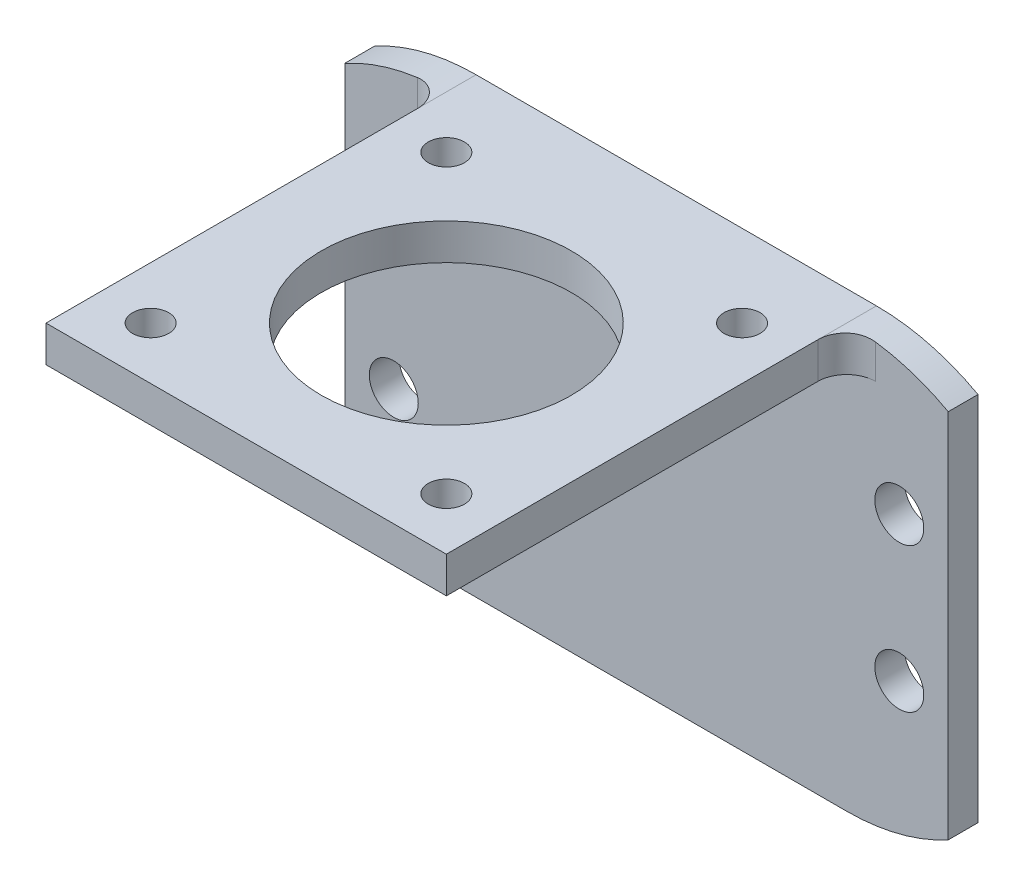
SolidWorks part; units mm, degrees
ref_plane "Front Plane" through (0, 0, 0) normal (0, 0, 1) x (1, 0, 0)
ref_plane "Top Plane" through (0, 0, 0) normal (0, 1, 0) x (1, 0, 0)
ref_plane "Right Plane" through (0, 0, 0) normal (1, 0, 0) x (0, 0, -1)
sketch "Sketch1" plane through (0, 0, 0) normal (0, 1, 0) x (1, 0, 0)
  line L0 (-13, 13) -> (-13, -13) construction
  line L1 (-17.6, -17.6) -> (17.6, -17.6)
  line L2 (-17.6, -17.6) -> (-17.6, 17.6)
  line L3 (-17.6, 17.6) -> (17.6, 17.6)
  line L4 (17.6, -17.6) -> (17.6, 17.6)
  line L5 (-17.6, -17.6) -> (17.6, 17.6) construction
  line L6 (-17.6, 17.6) -> (17.6, -17.6) construction
  line L7 (-13, -13) -> (13, -13) construction
  circle A0 centre (13, 13) radius 1.5875
  circle A1 centre (-13, 13) radius 1.5875
  circle A2 centre (13, -13) radius 1.5875
  circle A3 centre (-13, -13) radius 1.5875
  circle A4 centre (0, 0) radius 11
  point P0 (0, 0)
  point P9 (-13, 0)
  point P18 (0, -13)
  dimension "D2" = 26
  dimension "D4" = 3.175
  dimension "D5" = 22
  dimension "D1" = 35.2
  dimension "D3" = 26
extrude "Boss-Extrude1" add sketch "Sketch1" along normal blind 3.175
sketch "Sketch3" plane through (0, 3.175, 0) normal (0, 1, 0) x (1, 0, 0)
  line L0 (-17.6, 17.6) -> (-17.6, 20.2162)
  line L1 (-17.6, 20.2162) -> (17.6, 20.2162)
  line L2 (17.6, 17.6) -> (17.6, 20.2162)
  line L3 (-17.6, 17.6) -> (17.6, 17.6)
  dimension "D1" = 2.6162
extrude "Boss-Extrude2" add sketch "Sketch3" against normal blind 37.175
sketch "Sketch5" plane through (0, 0, -17.6) normal (0, 0, 1) x (1, 0, 0)
  line L2 (-17.6, -34) -> (-17.6, 3.175) construction
  line L3 (-17.6, -34) -> (-17.6, 3.175) construction
  line L4 (-17.6, -34) -> (-17.6, 3.175)
  arc A1 (-17.6, 3.175) -> (-17.6, -34) centre (-17.6, -15.4125) ccw
extrude "Boss-Extrude3" add sketch "Sketch5" against normal up to surface (2.6162 mm away)
mirror "Mirror1" about plane through (0, 0, 0) normal (1, 0, 0) of "Boss-Extrude3"
fillet "Fillet1" radius 2.54 2 edges at (-17.6, 1.5875, -17.6) (17.6, 1.5875, -17.6)
sketch "Sketch6" plane through (0, 0, -17.6) normal (0, 0, 1) x (1, 0, 0)
  line L0 (-17.6, -34) -> (-17.6, 3.175) construction
  line L1 (17.6, 3.175) -> (-17.6, 3.175) construction
  line L2 (-22.2228, -21.7625) -> (-22.2228, -9.0625) construction
  line L3 (17.6, 3.175) -> (-17.6, 3.175) construction
  circle A0 centre (-22.2228, -21.7625) radius 2.1526
  circle A1 centre (-22.2228, -9.0625) radius 2.1527
  point P6 (0, 0)
  point P8 (-17.6, 9.3202)
  point P9 (-22.2228, -15.4125)
  point P10 (-17.6, -15.4125)
  point P11 (-17.6, 0)
  dimension "D1" = 4.3053
  dimension "D2" = 4.3053
  dimension "D3" = 12.7
  dimension "D4" = 4.6228
extrude "Cut-Extrude1" cut sketch "Sketch6" against normal up to surface (2.6162 mm away)
mirror "Mirror2" about plane through (0, 0, 0) normal (1, 0, 0) of "Cut-Extrude1"
sketch "Sketch7" plane through (0, 0, -17.6) normal (0, 0, 1) x (1, 0, 0)
  line L1 (-45.749, -72.7391) -> (-26.5281, -72.7391)
  line L2 (-45.749, -72.7391) -> (-45.749, 2.2878)
  line L3 (-45.749, 2.2878) -> (-26.5281, 2.2878)
  line L4 (-26.5281, -72.7391) -> (-26.5281, 2.2878)
  line L5 (-45.749, -72.7391) -> (-26.5281, 2.2878) construction
  line L6 (-45.749, 2.2878) -> (-26.5281, -72.7391) construction
  circle A0 centre (-22.2228, -21.7625) radius 2.1526 construction
  point P0 (-36.1385, -35.2257)
  dimension "D1" = 4.3053
extrude "Cut-Extrude2" cut sketch "Sketch7" against normal up to surface (2.6162 mm away)
mirror "Mirror3" about plane through (0, 0, 0) normal (1, 0, 0) of "Cut-Extrude2"
